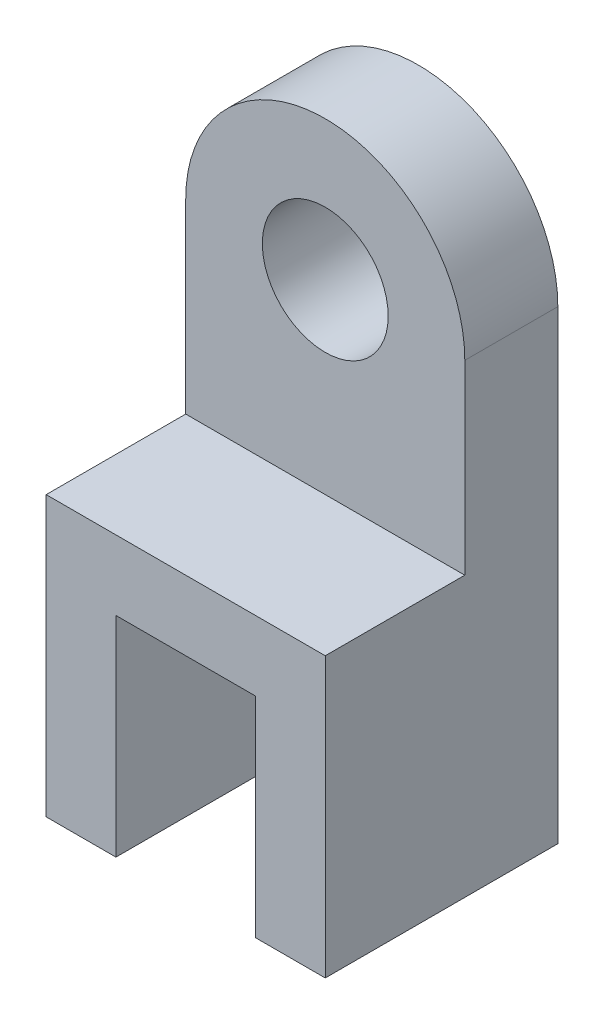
SolidWorks part; units mm, degrees
ref_plane "Front" through (0, 0, 0) normal (0, 0, 1) x (1, 0, 0)
ref_plane "Top" through (0, 0, 0) normal (0, 1, 0) x (1, 0, 0)
ref_plane "Right" through (0, 0, 0) normal (1, 0, 0) x (0, 0, -1)
sketch "Sketch1" plane through (0, 0, 0) normal (0, 0, 1) x (1, 0, 0)
  line L1 (-30, -40) -> (30, -40)
  line L2 (-30, -40) -> (-30, 0)
  line L4 (30, -40) -> (30, 0)
  arc A0 (30, 0) -> (-30, 0) centre (0, 0) ccw
  dimension "D1" = 30
  dimension "D2" = 40
extrude "Base-Extrude" add sketch "Sketch1" along normal mid plane 20
sketch "Sketch2" plane through (0, -40, 0) normal (0, -1, 0) x (1, 0, 0)
  line L0 (30, 10) -> (30, -10) construction
  line L1 (-30, -10) -> (30, -10)
  line L2 (-30, -10) -> (-30, 40)
  line L3 (-30, 40) -> (30, 40)
  line L4 (30, -10) -> (30, 40)
  dimension "D1" = 50
extrude "Boss-Extrude1" add sketch "Sketch2" along normal blind 10
sketch "Sketch3" plane through (0, 0, 10) normal (0, 0, 1) x (1, 0, 0)
  circle A0 centre (0, 0) radius 13.5287
  arc A1 (30, 0) -> (-30, 0) centre (0, 0) ccw construction
extrude "Cut-Extrude1" cut sketch "Sketch3" against normal blind 61
sketch "Sketch7" plane through (0, 0, 40) normal (0, 0, 1) x (1, 0, 0)
  line L0 (-30, -50) -> (-30, -100)
  line L1 (-30, -100) -> (-15, -100)
  line L2 (-15, -100) -> (-15, -55)
  line L3 (-15, -55) -> (15, -55)
  line L4 (15, -55) -> (15, -100)
  line L5 (15, -100) -> (30, -100)
  line L6 (30, -100) -> (30, -50)
  line L7 (-30, -50) -> (30, -50)
  line L8 (30, -40) -> (-30, -40) construction
  dimension "D1" = 60
  dimension "D2" = 15
  dimension "D3" = 45
extrude "Boss-Extrude2" add sketch "Sketch7" against normal up to surface (50 mm away)
